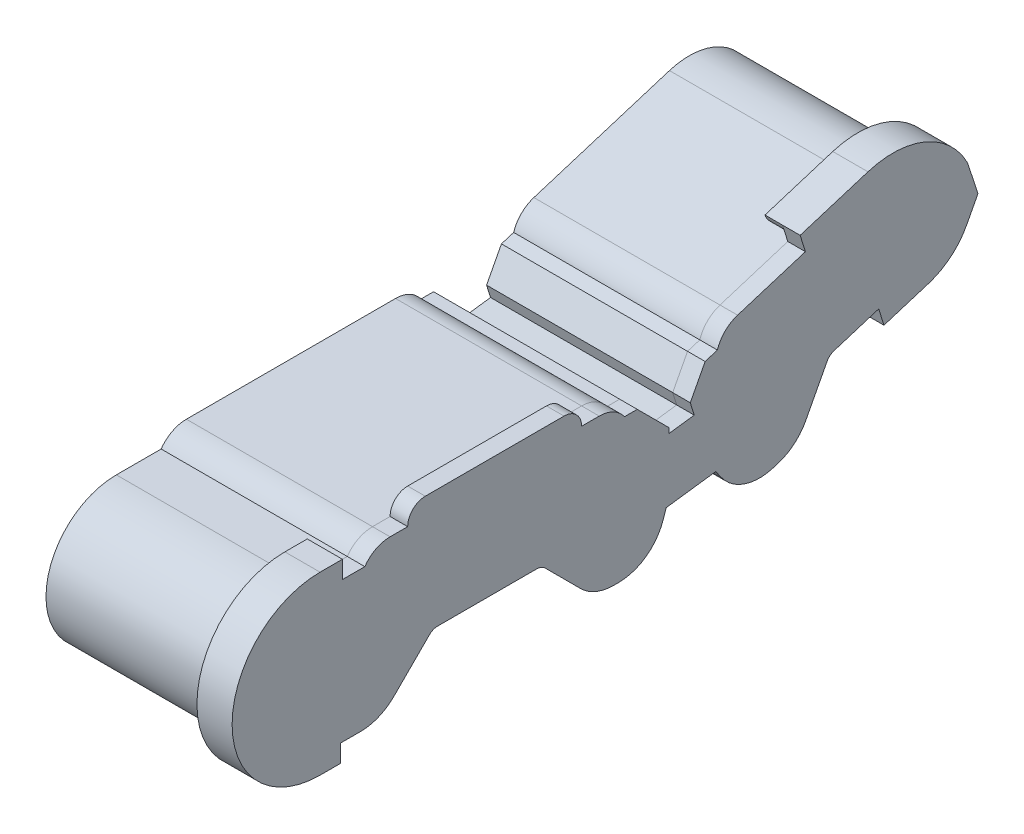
SolidWorks part; units mm, degrees
other "<shell_fp>-<<finger_pivot>-<Pad Material[1]>>"
other "<shell_fp>-<<finger_pivot>-<Pad Material[2]>>"
other "<shell_fp>-<<finger_pivot>-<Pad Material[3]>>"
other "<shell_fp>-<<finger_pivot>-<Wall Removal[1]>>"
other "<shell_fp>-<<finger_pivot>-<Wall Removal[2]>>"
other "<shell_fp>-<Contouring>"
ref_plane "Front Plane" through (0, 0, 0) normal (0, 0, 1) x (1, 0, 0)
ref_plane "Top Plane" through (0, 0, 0) normal (0, 1, 0) x (1, 0, 0)
ref_plane "Right Plane" through (0, 0, 0) normal (1, 0, 0) x (0, 0, -1)
inserted part "shell_fp"
sketch "Sketch1" plane through (15.875, 0, 0) normal (1, 0, 0) x (0, 0, -1)
  line L23 (54.1167, 12) -> (51.9325, 12)
  line L24 (47.6241, 14.25) -> (11.95, 14.25)
  line L25 (7.6416, 12) -> (0, 12)
  line L26 (0, -12) -> (6.9289, -12)
  line L27 (12.5858, -9.6569) -> (18.6569, -3.5858)
  line L28 (20.0711, -3) -> (36.9754, -3)
  line L29 (38.3896, -3.5858) -> (44.4606, -9.6569)
  line L30 (50.1175, -12) -> (50.9402, -12)
  line L31 (58.5258, -6.5414) -> (59.0432, -4.997)
  line L32 (59.0432, -4.997) -> (67.4895, -3.885)
  line L33 (67.4895, -3.885) -> (68.4762, -5.2588)
  line L34 (77.3495, -8.2311) -> (78.1282, -7.9889)
  line L35 (82.8341, -4.0717) -> (86.4934, 2.8908)
  line L36 (87.6699, 3.8701) -> (102.9481, 8.6213)
  line L37 (107.6539, 12.5385) -> (108.9953, 15.0907)
  line L38 (108.9953, 15.0907) -> (107.6723, 19.1049)
  line L39 (94.3613, 24.5492) -> (71.2277, 17.3552)
  line L40 (67.7817, 13.9273) -> (65.696, 13.2787)
  line L41 (65.696, 13.2787) -> (63.1602, 8.4538)
  line L42 (63.1602, 8.4538) -> (63.8346, 6.2852)
  line L43 (63.8346, 6.2852) -> (59.5464, 5.7206)
  line L44 (59.5464, 5.7206) -> (59.5464, 6.5703)
  line L45 (59.5464, 6.5703) -> (54.1167, 12)
  line L46 (54.1167, 12) -> (51.9325, 12)
  line L47 (47.6241, 14.25) -> (11.95, 14.25)
  line L48 (7.6416, 12) -> (0, 12)
  line L49 (0, -12) -> (6.9289, -12)
  line L50 (12.5858, -9.6569) -> (18.6569, -3.5858)
  line L51 (20.0711, -3) -> (36.9754, -3)
  line L52 (38.3896, -3.5858) -> (44.4606, -9.6569)
  line L53 (50.1175, -12) -> (50.9402, -12)
  line L54 (58.5258, -6.5414) -> (59.0432, -4.997)
  line L55 (59.0432, -4.997) -> (67.4895, -3.885)
  line L56 (67.4895, -3.885) -> (68.4762, -5.2588)
  line L57 (77.3495, -8.2311) -> (78.1282, -7.9889)
  line L58 (82.8341, -4.0717) -> (86.4934, 2.8908)
  line L59 (87.6699, 3.8701) -> (102.9481, 8.6213)
  line L60 (107.6539, 12.5385) -> (108.9953, 15.0907)
  line L61 (108.9953, 15.0907) -> (107.6723, 19.1049)
  line L62 (94.3613, 24.5492) -> (71.2277, 17.3552)
  line L63 (67.7817, 13.9273) -> (65.696, 13.2787)
  line L64 (65.696, 13.2787) -> (63.1602, 8.4538)
  line L65 (63.1602, 8.4538) -> (63.8346, 6.2852)
  line L66 (63.8346, 6.2852) -> (59.5464, 5.7206)
  line L67 (59.5464, 5.7206) -> (59.5464, 6.5703)
  line L68 (59.5464, 6.5703) -> (54.1167, 12)
  arc A14 (51.9325, 12) -> (47.6241, 14.25) centre (47.6241, 9) ccw
  arc A15 (11.95, 14.25) -> (7.6416, 12) centre (11.95, 9) ccw
  arc A16 (0, 12) -> (0, -12) centre (0, 0) ccw
  arc A17 (6.9289, -12) -> (12.5858, -9.6569) centre (6.9289, -4) ccw
  arc A18 (20.0711, -3) -> (18.6569, -3.5858) centre (20.0711, -5) ccw
  arc A19 (38.3896, -3.5858) -> (36.9754, -3) centre (36.9754, -5) ccw
  arc A20 (44.4606, -9.6569) -> (50.1175, -12) centre (50.1175, -4) ccw
  arc A21 (50.9402, -12) -> (58.5258, -6.5414) centre (50.9402, -4) ccw
  arc A22 (68.4762, -5.2588) -> (77.3495, -8.2311) centre (74.9739, -0.5919) ccw
  arc A23 (78.1282, -7.9889) -> (82.8341, -4.0717) centre (75.7526, -0.3498) ccw
  arc A24 (87.6699, 3.8701) -> (86.4934, 2.8908) centre (88.2638, 1.9603) ccw
  arc A25 (102.9481, 8.6213) -> (107.6539, 12.5385) centre (100.5725, 16.2604) ccw
  arc A26 (107.6723, 19.1049) -> (94.3613, 24.5492) centre (97.7168, 13.7589) ccw
  arc A27 (71.2277, 17.3552) -> (67.7817, 13.9273) centre (72.7866, 12.342) ccw
  arc A28 (51.9325, 12) -> (47.6241, 14.25) centre (47.6241, 9) ccw
  arc A29 (11.95, 14.25) -> (7.6416, 12) centre (11.95, 9) ccw
  arc A30 (0, 12) -> (0, -12) centre (0, 0) ccw
  arc A31 (6.9289, -12) -> (12.5858, -9.6569) centre (6.9289, -4) ccw
  arc A32 (20.0711, -3) -> (18.6569, -3.5858) centre (20.0711, -5) ccw
  arc A33 (38.3896, -3.5858) -> (36.9754, -3) centre (36.9754, -5) ccw
  arc A34 (44.4606, -9.6569) -> (50.1175, -12) centre (50.1175, -4) ccw
  arc A35 (50.9402, -12) -> (58.5258, -6.5414) centre (50.9402, -4) ccw
  arc A36 (68.4762, -5.2588) -> (77.3495, -8.2311) centre (74.9739, -0.5919) ccw
  arc A37 (78.1282, -7.9889) -> (82.8341, -4.0717) centre (75.7526, -0.3498) ccw
  arc A38 (87.6699, 3.8701) -> (86.4934, 2.8908) centre (88.2638, 1.9603) ccw
  arc A39 (102.9481, 8.6213) -> (107.6539, 12.5385) centre (100.5725, 16.2604) ccw
  arc A40 (107.6723, 19.1049) -> (94.3613, 24.5492) centre (97.7168, 13.7589) ccw
  arc A41 (71.2277, 17.3552) -> (67.7817, 13.9273) centre (72.7866, 12.342) ccw
  dimension "D1" = 0
extrude "Bottom" add sketch "Sketch1" along normal blind 3 separate body
sketch "Sketch3" plane through (18.875, 0, 0) normal (1, 0, 0) x (0, 0, -1)
  line L2 (0, -12) -> (6.9289, -12) construction
  line L3 (7.6416, 12) -> (0, 12) construction
  line L4 (81.9036, 23.8169) -> (93.4705, 27.4139)
  line L6 (7.6416, 12) -> (0, 12) construction
  line L7 (0, -12) -> (6.9289, -12) construction
  line L8 (87.6699, 3.8701) -> (102.9481, 8.6213) construction
  line L9 (108.9953, 15.0907) -> (107.6723, 19.1049) construction
  line L10 (107.6539, 12.5385) -> (108.9953, 15.0907) construction
  line L11 (94.3613, 24.5492) -> (71.2277, 17.3552) construction
  line L12 (3.8208, 12) -> (0, 12)
  line L13 (3.4645, -12) -> (0, -12)
  line L14 (82.7945, 20.9522) -> (94.3613, 24.5492)
  line L15 (95.309, 6.2457) -> (102.9481, 8.6213)
  line L16 (112.2428, 14.8213) -> (110.4443, 20.2783)
  line L17 (110.3095, 11.1428) -> (112.2428, 14.8213)
  line L18 (96.1998, 3.381) -> (103.8389, 5.7566)
  line L19 (81.9036, 23.8169) -> (82.7945, 20.9522)
  line L20 (3.8208, 15) -> (0, 15)
  line L21 (3.4645, -15) -> (0, -15)
  line L22 (3.8208, 15) -> (3.8208, 12)
  line L23 (3.4645, -12) -> (3.4645, -15)
  line L24 (95.309, 6.2457) -> (96.1998, 3.381)
  line L25 (94.3613, 24.5492) -> (71.2277, 17.3552) construction
  line L28 (108.9953, 15.0907) -> (107.6723, 19.1049)
  line L29 (107.6539, 12.5385) -> (108.9953, 15.0907)
  line L30 (87.6699, 3.8701) -> (102.9481, 8.6213) construction
  arc A0 (110.4443, 20.2783) -> (93.4705, 27.4139) centre (97.7168, 13.7589) ccw
  arc A1 (103.8389, 5.7566) -> (110.3095, 11.1428) centre (100.5725, 16.2604) ccw
  arc A3 (0, 12) -> (0, -12) centre (0, 0) ccw construction
  arc A4 (107.6723, 19.1049) -> (94.3613, 24.5492) centre (97.7168, 13.7589) ccw construction
  arc A5 (102.9481, 8.6213) -> (107.6539, 12.5385) centre (100.5725, 16.2604) ccw construction
  arc A8 (0, 15) -> (0, -15) centre (0, 0) ccw
  arc A9 (0, 12) -> (0, -12) centre (0, 0) ccw construction
  arc A10 (0, 12) -> (0, -12) centre (0, 0) ccw
  arc A13 (107.6723, 19.1049) -> (94.3613, 24.5492) centre (97.7168, 13.7589) ccw
  arc A14 (102.9481, 8.6213) -> (107.6539, 12.5385) centre (100.5725, 16.2604) ccw
  dimension "D1" = 3
  dimension "D2" = 3
extrude "Flanges" add sketch "Sketch3" against normal blind 6
sketch "Sketch4" plane through (15.875, 0, 0) normal (-1, 0, 0) x (0, 0, 1)
  line L0 (-44.6241, 14.25) -> (-14.95, 14.25)
  line L1 (-47.6241, 14.25) -> (-11.95, 14.25) construction
  line L2 (-14.95, 14.25) -> (-14.95, 17.25)
  line L3 (-14.95, 17.25) -> (-44.6241, 17.25)
  line L4 (-44.6241, 17.25) -> (-44.6241, 14.25)
  dimension "D1" = 3
  dimension "D2" = 3
  dimension "D3" = 3
extrude "Helper Tab" add sketch "Sketch4" against normal up to surface (3 mm away)
fillet "Contouring" radius 3 6 edges at (14.375, -12, -3.4645) (14.375, 12, -3.8208) (14.375, 20.9522, -82.7945) (14.375, 6.2457, -95.309) (17.375, 17.25, -14.95) (17.375, 17.25, -44.6241)
ref_point "Ref Center"
equation "\"D2@Sketch3\"=\"width keep@values@params_print.sldprt\""
equation "\"D1@Sketch3\"=\"D2@Sketch3\""
equation "\"D1@Contouring\"=\"width keep@values@params_print.sldprt\""
equation "\"D1@Flanges\"=2*\"width keep@values@params_print.sldprt\""
equation "\"D1@Bottom\"=\"width keep@values@params_print.sldprt\""
equation "\"D1@Sketch4\"=\"width keep@values@params_print.sldprt\""
equation "\"D2@Sketch4\"=\"D1@Sketch4\""
equation "\"D3@Sketch4\"=\"D1@Sketch4\""
